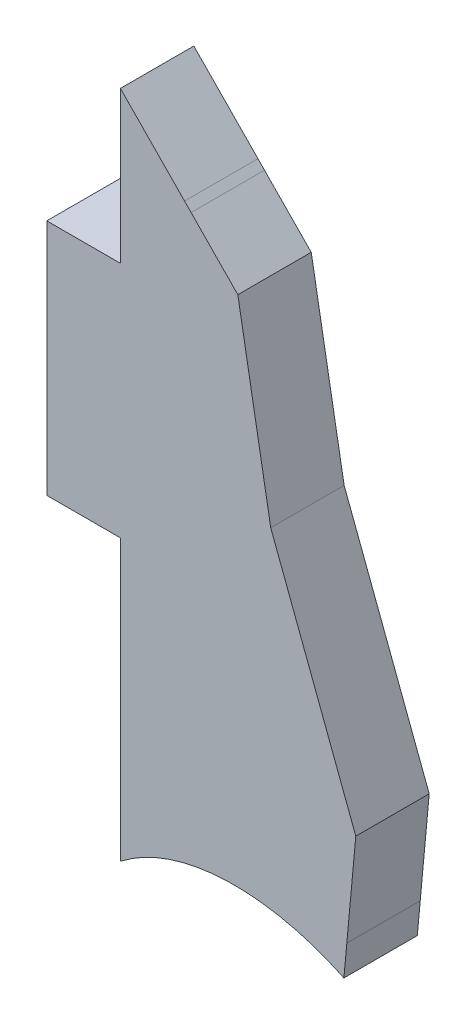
SolidWorks part; units mm, degrees
ref_plane "Alzado" through (0, 0, 0) normal (0, 0, 1) x (1, 0, 0)
ref_plane "Planta" through (0, 0, 0) normal (0, 1, 0) x (1, 0, 0)
ref_plane "Vista lateral" through (0, 0, 0) normal (1, 0, 0) x (0, 0, -1)
sketch "Croquis2" plane through (0, 0, 0) normal (0, 0, 1) x (1, 0, 0)
sketch_block_instance "F1 CAR CUT corte-1"
sketch_block "Bloque1"
extrude "Saliente-Extruir1" add sketch "Croquis2" along normal blind 3
delete or keep bodies "Sólido-Eliminar/Conservar 27" type delete bodies bodies 109 105 110 106 111 107
delete or keep bodies "Sólido-Eliminar/Conservar 33" type delete bodies bodies 102 101 103 108
delete or keep bodies "Sólido-Eliminar/Conservar 35" type delete bodies bodies 104 114
delete or keep bodies "Sólido-Eliminar/Conservar 36" type delete bodies bodies 113
